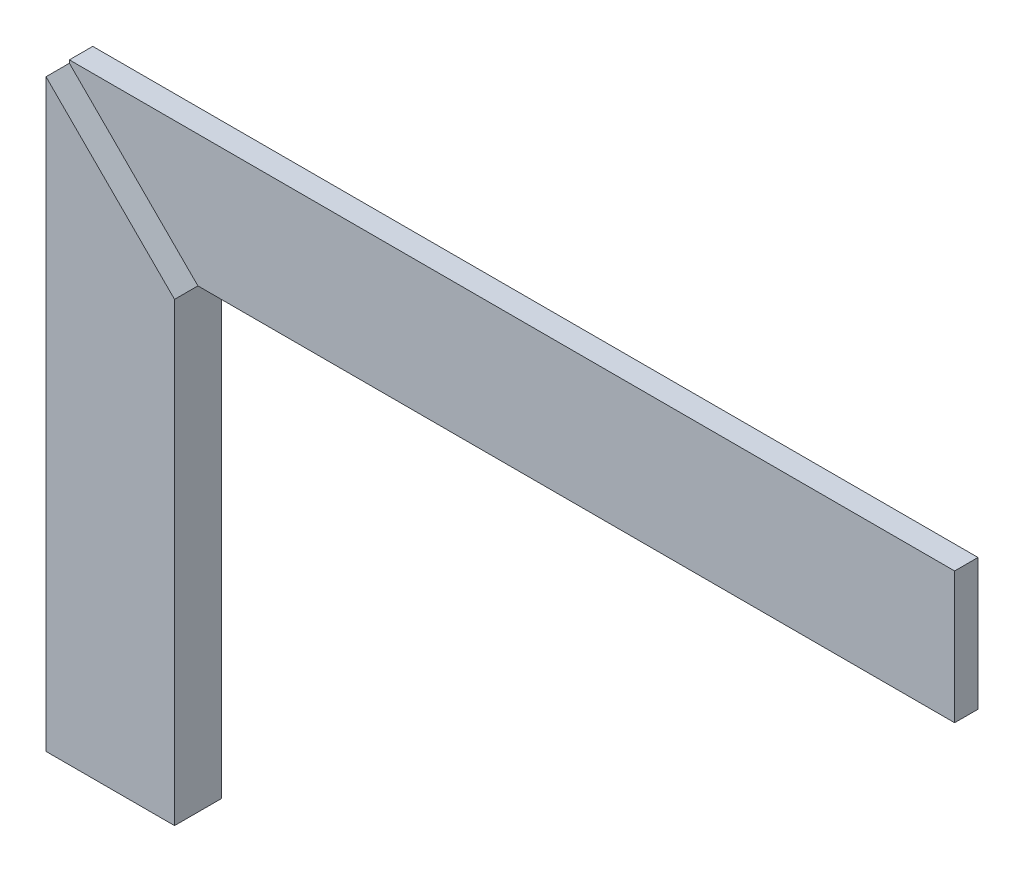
SolidWorks part; units mm, degrees
ref_plane "Front" through (0, 0, 0) normal (0, 0, 1) x (1, 0, 0)
ref_plane "Top" through (0, 0, 0) normal (0, 1, 0) x (1, 0, 0)
ref_plane "Right" through (0, 0, 0) normal (1, 0, 0) x (0, 0, -1)
sketch "Esquisse1" plane through (0, 0, 0) normal (0, 0, 1) x (1, 0, 0)
  line L0 (0, 0) -> (303, 0)
  line L1 (303, 0) -> (303, -45)
  line L2 (303, -45) -> (44, -45)
  line L3 (44, -45) -> (44, -201)
  line L4 (44, -201) -> (0, -201)
  line L5 (0, -201) -> (0, 0)
  dimension "D1" = 303
  dimension "D2" = 156
  dimension "D3" = 45
  dimension "D4" = 44
extrude "Boss.-Extru.1" add sketch "Esquisse1" along normal blind 16
sketch "Esquisse2" plane through (0, 0, 16) normal (0, 0, 1) x (1, 0, 0)
  line L0 (44, -45) -> (0, -1)
  line L1 (0, 0) -> (0, -201) construction
  line L2 (44, -45) -> (303, -45) construction
  line L3 (0, -1) -> (0, 0)
  line L4 (0, 0) -> (303, 0)
  line L5 (303, 0) -> (303, -45)
  line L6 (303, -45) -> (44, -45)
  dimension "D1" = 135
extrude "Enlèv. mat.-Extru.1" cut sketch "Esquisse2" against normal blind 8
